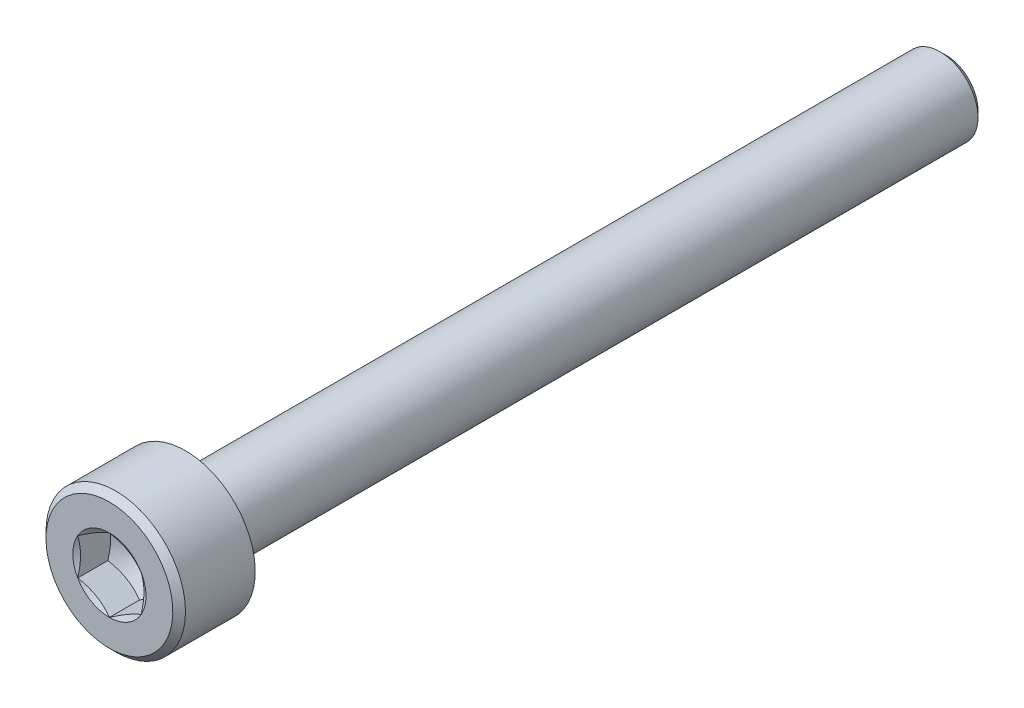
SolidWorks part; units mm, degrees
ref_plane "Front" through (0, 0, 0) normal (0, 0, 1) x (1, 0, 0)
ref_plane "Top" through (0, 0, 0) normal (0, 1, 0) x (1, 0, 0)
ref_plane "Right" through (0, 0, 0) normal (1, 0, 0) x (0, 0, -1)
sketch "Sketch1" plane through (0, 0, 0) normal (1, 0, 0) x (0, 0, -1)
  line L0 (0, 2.75) -> (-3, 2.75)
  line L1 (-3, 2.75) -> (-3, 0)
  line L2 (-3, 0) -> (30, 0)
  line L3 (30, 0) -> (30, 1.5)
  line L4 (30, 1.5) -> (0, 1.5)
  line L5 (0, 1.5) -> (0, 2.75)
  line L6 (0, 0) -> (12.7561, 0) construction
  dimension "l" = 30
  dimension "d" = 3
  dimension "k" = 3
  dimension "dk" = 5.5
revolve "Revolve1" add sketch "Sketch1" angle 360 about L2
sketch "Sketch7" plane through (0, 0, 0) normal (1, 0, 0) x (0, 0, -1)
  line L0 (-6.6396, 0) -> (3.6195, 0) construction
  line L1 (-3, 0) -> (-3, 1.25)
  line L2 (-3, 2.75) -> (-3, -2.75) construction
  line L3 (-3, 1.25) -> (-1.7, 1.25)
  line L4 (-1.7, 1.25) -> (-0.9783, 0)
  line L6 (-3, 0) -> (-0.9783, 0)
  dimension "D1" = 60
  dimension "S" = 2.5
  dimension "t" = 1.3
revolve "Cut-Revolve2" cut sketch "Sketch7" angle 360 about L6
chamfer "Chamfer1" distance 0.25 2 edges at (0, -1.5, -30) (0, -2.75, 3)
sketch "Sketch8" plane through (0, 0, 3) normal (0, 0, 1) x (1, 0, 0)
  line L1 (0, 1.4434) -> (-1.25, 0.7217)
  line L2 (-1.25, 0.7217) -> (-1.25, -0.7217)
  line L3 (-1.25, -0.7217) -> (0, -1.4434)
  line L4 (0, -1.4434) -> (1.25, -0.7217)
  line L5 (1.25, -0.7217) -> (1.25, 0.7217)
  line L6 (1.25, 0.7217) -> (0, 1.4434)
  circle A0 centre (0, 0) radius 1.25 construction
  circle A1 centre (0, 0) radius 1.25 construction
extrude "Cut-Extrude1" cut sketch "Sketch8" against normal up to surface (1.1884 mm away)
sketch "Sketch9" plane through (0, 0, 0) normal (1, 0, 0) x (0, 0, -1)
  line L0 (-3, 1.25) -> (4.2695, 1.25) construction
  line L3 (-3.5, 2.3094) -> (-3.5, 1.25)
  line L4 (-3.5, 1.25) -> (-2.8884, 1.25)
  line L5 (-2.8884, 1.25) -> (-3.5, 2.3094)
  line L6 (-3, 2.75) -> (-3, -2.75) construction
  dimension "D1" = 60
  dimension "D2" = 0.5
revolve "Cut-Revolve3" cut sketch "Sketch9" angle 360 about axis through (0, 0, 3) along (0, 0, -1)
fillet "Fillet2" radius 0.4 1 edges at (0, -1.5, 0)
